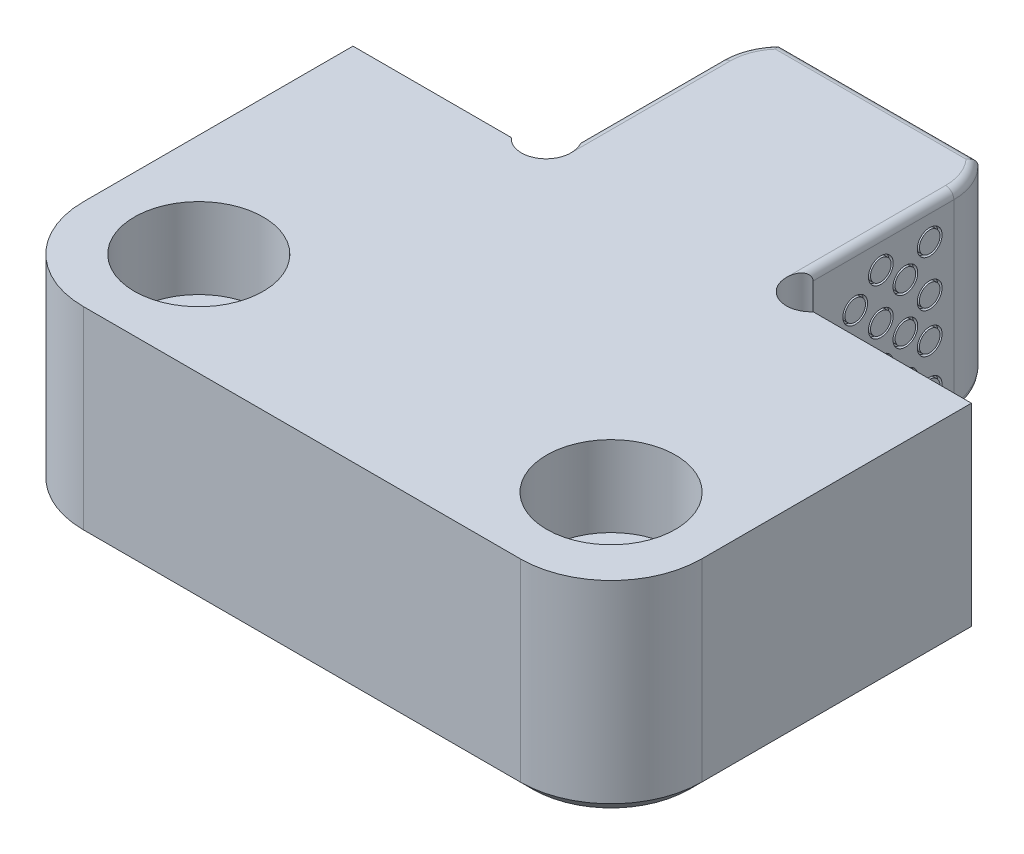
SolidWorks part; units mm, degrees
ref_plane "Front Plane" through (0, 0, 0) normal (0, 0, 1) x (1, 0, 0)
ref_plane "Top Plane" through (0, 0, 0) normal (0, 1, 0) x (1, 0, 0)
ref_plane "Right Plane" through (0, 0, 0) normal (1, 0, 0) x (0, 0, -1)
sketch "Sketch1" plane through (0, 0, 0) normal (0, 1, 0) x (1, 0, 0)
  line L0 (-19.05, -22.1996) -> (19.05, -22.1996)
  line L6 (-7.1476, 0) -> (-7.1476, 13.3604)
  line L7 (-7.1476, 13.3604) -> (7.1476, 13.3604)
  line L8 (7.1476, 13.3604) -> (7.1476, 0)
  line L9 (7.1476, 0) -> (19.05, 0)
  line L10 (19.05, 0) -> (19.05, -22.1996)
  line L12 (0, 0) -> (0, 50000) construction
  line L13 (0, 0) -> (-50000, 0) construction
  line L21 (-19.05, 0) -> (-19.05, -22.1996)
  line L22 (-7.1476, 0) -> (-19.05, 0)
  dimension "D1" = 14.2951
  dimension "D2" = 22.1996
  dimension "D3" = 35.56
  dimension "D4" = 38.1
extrude "Boss-Extrude1" add sketch "Sketch1" against normal blind 12.6746 separate body
sketch "Sketch2" plane through (0, 0, 0) normal (0, 1, 0) x (1, 0, 0)
  line L0 (0, 0) -> (50000, 0) construction
  line L1 (0, 0) -> (0, 50000) construction
  line L4 (-7.1476, 13.3604) -> (-7.1476, 0) construction
  line L5 (7.1476, 13.3604) -> (-7.1476, 13.3604) construction
  line L12 (7.1476, 7.0104) -> (7.1476, 10.8204)
  line L13 (7.1476, 7.0104) -> (12.7, 7.0104)
  line L14 (12.7, 7.0104) -> (12.7, 19.7104)
  line L15 (-12.7, 19.7104) -> (12.7, 19.7104)
  line L16 (-12.7, 7.0104) -> (-12.7, 19.7104)
  line L17 (-7.1476, 7.0104) -> (-12.7, 7.0104)
  line L18 (-7.1476, 7.0104) -> (-7.1476, 10.8204)
  line L19 (-6.0952, 13.3604) -> (6.0952, 13.3604)
  arc A0 (7.1476, 10.8204) -> (6.8175, 12.8409) centre (0.7976, 10.8204) ccw construction
  arc A1 (6.8175, 12.8409) -> (6.0952, 13.3604) centre (6.0952, 12.5984) ccw construction
  arc A2 (7.1476, 10.8204) -> (6.0952, 13.3604) centre (3.5562, 10.8204) ccw
  arc A6 (-6.8175, 12.8409) -> (-6.0952, 13.3604) centre (-6.0952, 12.5984) cw construction
  arc A7 (-7.1476, 10.8204) -> (-6.8175, 12.8409) centre (-0.7976, 10.8204) cw construction
  arc A8 (-7.1476, 10.8204) -> (-6.0952, 13.3604) centre (-3.5562, 10.8204) cw
  dimension "D1" = 6.35
  dimension "D3" = 25.4
  dimension "D4" = 0.762
  dimension "D5" = 6.35
  dimension "D6" = 2.54
  dimension "D2" = 12.7
extrude "Cut-Extrude1" cut sketch "Sketch2" against normal through all
sketch "Sketch3" plane through (0, 0, 0) normal (0, 1, 0) x (1, 0, 0)
  line L0 (0, 0) -> (0, 50000) construction
  line L1 (0, 0) -> (50000, 0) construction
  line L6 (19.05, -0.508) -> (7.1476, -0.508)
  line L7 (19.05, -0.508) -> (7.1476, -0.508) construction
  line L9 (6.6396, 0) -> (6.6396, 10.8204)
  line L10 (6.6396, 0) -> (6.6396, 10.8204) construction
  circle A0 centre (8.1636, 1.016) radius 1.524
  circle A1 centre (-8.1636, 1.016) radius 1.524
  dimension "D1" = 1.524
  dimension "D2" = 0.508
  dimension "D3" = 0.508
extrude "Cut-Extrude2" cut sketch "Sketch3" against normal through all
sketch "Sketch5" plane through (19.05, 0, 0) normal (1, 0, 0) x (0, 0, -1)
  line L0 (-63.088, -12.4206) -> (49936.912, -12.4206) construction
  line L1 (-22.1996, -12.6746) -> (0, -12.6746) construction
  line L2 (13.3604, -12.6746) -> (13.3604, 0) construction
  line L3 (0, 9.7237) -> (0, -49990.2763) construction
  line L4 (0, -12.6746) -> (0, 0) construction
  line L5 (-11.0998, 0) -> (-11.0998, 50000) construction
  line L6 (-22.1996, 0) -> (0, 0) construction
  line L7 (0, -12.4206) -> (0, -29.0507)
  line L8 (0, -12.4206) -> (3.2004, -12.4206)
  line L9 (50.8, 9.0493) -> (50.8, -29.0507)
  line L10 (50.8, -29.0507) -> (0, -29.0507)
  arc A0 (3.2004, -12.4206) -> (50.8, 9.0493) centre (3.2004, 51.0794) ccw
  point P16 (-11.0998, 0)
  dimension "D2" = 63.5
  dimension "D3" = 10.16
  dimension "D1" = 0.254
  dimension "D4" = 38.1
  dimension "D5" = 50.8
extrude "Cut-Extrude3" cut sketch "Sketch5" against normal through all
fillet "Fillet1" radius 5.588 2 edges at (-19.05, -6.3373, 22.1996) (19.05, -6.3373, 22.1996)
fillet "Fillet2" radius 0.508 12 edges at (-6.7967, -11.7553, -12.3686) (6.9419, -11.8054, -12.0183) (7.1476, 0, -6.4862) (-6.874, 0, -12.1951) (0, -11.6025, -13.3604) (-7.1476, -12.3058, -7.0173) (7.1476, -12.3058, -7.0173) (6.874, 0, -12.1951) (0, 0, -13.3604) (-7.1476, 0, -6.4862) (-7.1476, -12.4206, -2.6762) (7.1476, -12.4206, -2.6762)
chamfer "Chamfer3" distance 0.762 angle 45 5 edges at (-19.05, -12.6746, 8.3058) (-17.4133, -12.6746, 20.5629) (0, -12.6746, 22.1996) (17.4133, -12.6746, 20.5629) (19.05, -12.6746, 8.3058)
hole_wizard "#8 CBORE" positions "Sketch7" profile "Sketch6" counterbore size "#8" standard "Ansi Inch"
sketch "Sketch7" plane through (0, 0, 0) normal (0, 1, 0) x (-1, 0, 0)
  line L0 (0, 0) -> (0, 50000) construction
  line L1 (0, 0) -> (50000, 0) construction
  line L2 (19.05, 0) -> (19.05, 16.6116) construction
  line L3 (13.462, 22.1996) -> (-13.462, 22.1996) construction
  point P0 (12.7, 15.8496)
  point P16 (-12.7, 15.8496)
  dimension "D1" = 6.35
  dimension "D2" = 6.35
sketch "Sketch6" plane through (-12.7, 0, 15.8496) normal (1, 0, 0) x (0, 0, 1)
  line L0 (0, 0) -> (0, 12.6746)
  line L1 (0, 12.6746) -> (2.2479, 12.6746)
  line L3 (2.2479, 12.6746) -> (2.2479, 4.9606)
  line L4 (2.2479, 4.9606) -> (3.9687, 4.9606)
  line L5 (3.9687, 4.9606) -> (3.9687, 0)
  line L7 (3.9687, 0) -> (0, 0)
  line L11 (0, -6.35) -> (0, 107.95) construction
  dimension "Thru Hole Dia." = 4.4958
  dimension "Thru Hole Depth" = 12.6746
  dimension "C'Bore Dia." = 7.9375
  dimension "C'Bore Depth" = 4.9606
sketch "Sketch8" plane through (7.1476, 0, 0) normal (1, 0, 0) x (0, 0, -1)
  circle A0 centre (9.3317, -2.0103) radius 0.762
  circle A1 centre (9.3317, -2.0103) radius 0.635
  circle A2 centre (9.3317, -4.8446) radius 0.762
  circle A3 centre (9.3317, -4.8446) radius 0.635
  circle A4 centre (9.3317, -7.2981) radius 0.762
  circle A5 centre (9.3317, -7.2981) radius 0.635
  circle A6 centre (6.3206, -2.0103) radius 0.762
  circle A7 centre (6.3206, -2.0103) radius 0.635
  circle A8 centre (6.3206, -4.8446) radius 0.762
  circle A9 centre (6.3206, -4.8446) radius 0.635
  circle A10 centre (6.3206, -7.2981) radius 0.762
  circle A11 centre (6.3206, -7.2981) radius 0.635
  circle A18 centre (7.8341, -3.2848) radius 0.762
  circle A19 centre (7.8341, -3.2848) radius 0.635
  circle A20 centre (7.8341, -6.1191) radius 0.762
  circle A21 centre (7.8341, -6.1191) radius 0.635
  circle A22 centre (9.3317, -9.9867) radius 0.762
  circle A23 centre (9.3317, -9.9867) radius 0.635
  circle A24 centre (4.7433, -3.3645) radius 0.762
  circle A25 centre (4.7433, -3.3645) radius 0.635
  circle A26 centre (4.7433, -6.1988) radius 0.762
  circle A27 centre (4.7433, -6.1988) radius 0.635
  circle A28 centre (6.3206, -9.9867) radius 0.762
  circle A29 centre (6.3206, -9.9867) radius 0.635
  circle A32 centre (7.8341, -8.8078) radius 0.762
  circle A33 centre (7.8341, -8.8078) radius 0.635
  circle A34 centre (4.7433, -8.8874) radius 0.762
  circle A35 centre (4.7433, -8.8874) radius 0.635
extrude "Cut-Extrude4" cut sketch "Sketch8" against normal blind 0.254
mirror "Mirror1" about plane through (0, 0, 0) normal (1, 0, 0) of "Cut-Extrude4"
